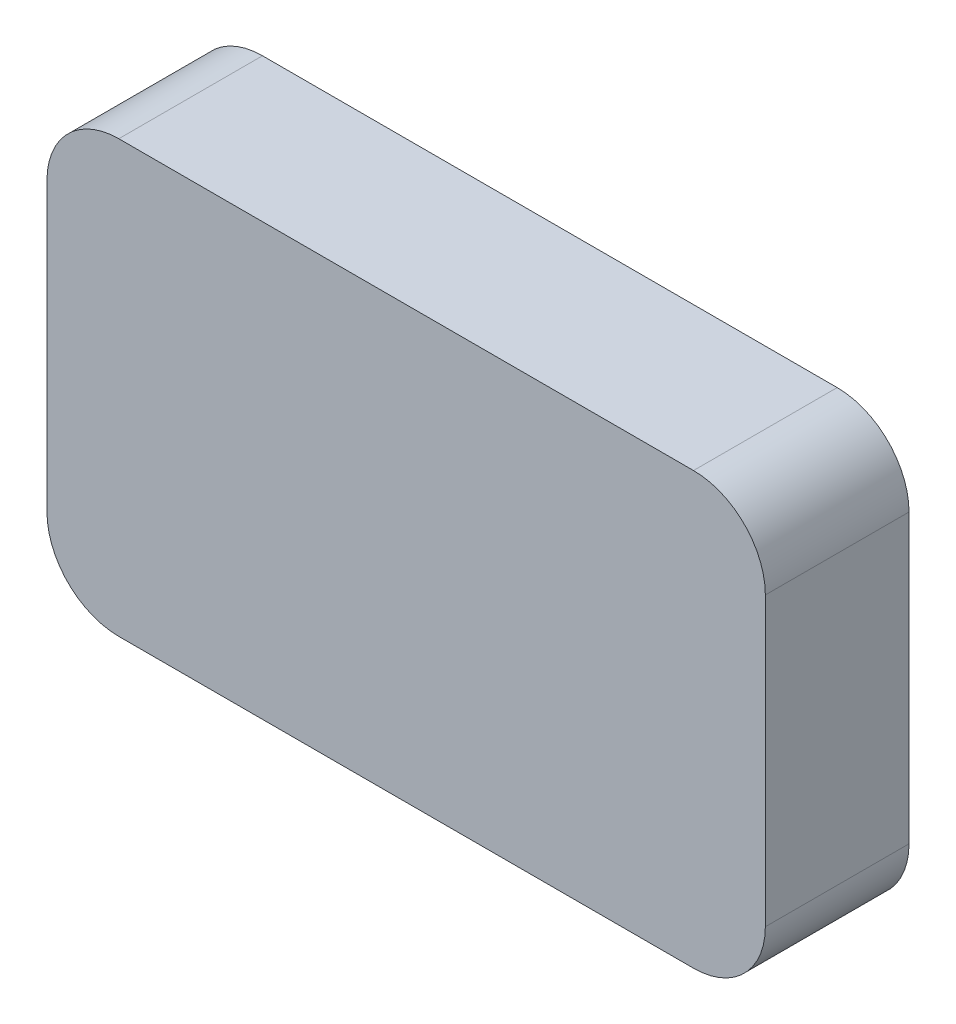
SolidWorks part; units mm, degrees
ref_plane "正面" through (0, 0, 0) normal (0, 0, 1) x (1, 0, 0)
ref_plane "平面" through (0, 0, 0) normal (0, 1, 0) x (1, 0, 0)
ref_plane "右側面" through (0, 0, 0) normal (1, 0, 0) x (0, 0, -1)
sketch "ｽｹｯﾁ1" plane through (0, 0, 0) normal (0, 0, 1) x (1, 0, 0)
  line L1 (-20, -15) -> (20, -15)
  line L2 (-25, -10) -> (-25, 10)
  line L3 (-20, 15) -> (20, 15)
  line L4 (25, -10) -> (25, 10)
  line L5 (-25, -15) -> (25, 15) construction
  line L6 (-25, 15) -> (25, -15) construction
  arc A0 (20, 15) -> (25, 10) centre (20, 10) cw
  arc A1 (25, -10) -> (20, -15) centre (20, -10) cw
  arc A2 (-20, -15) -> (-25, -10) centre (-20, -10) cw
  arc A3 (-25, 10) -> (-20, 15) centre (-20, 10) cw
  point P0 (0, 0)
  dimension "D3" = 5
  dimension "D1" = 50
  dimension "D2" = 30
extrude "ﾎﾞｽ - 押し出し1" add sketch "ｽｹｯﾁ1" along normal blind 10
